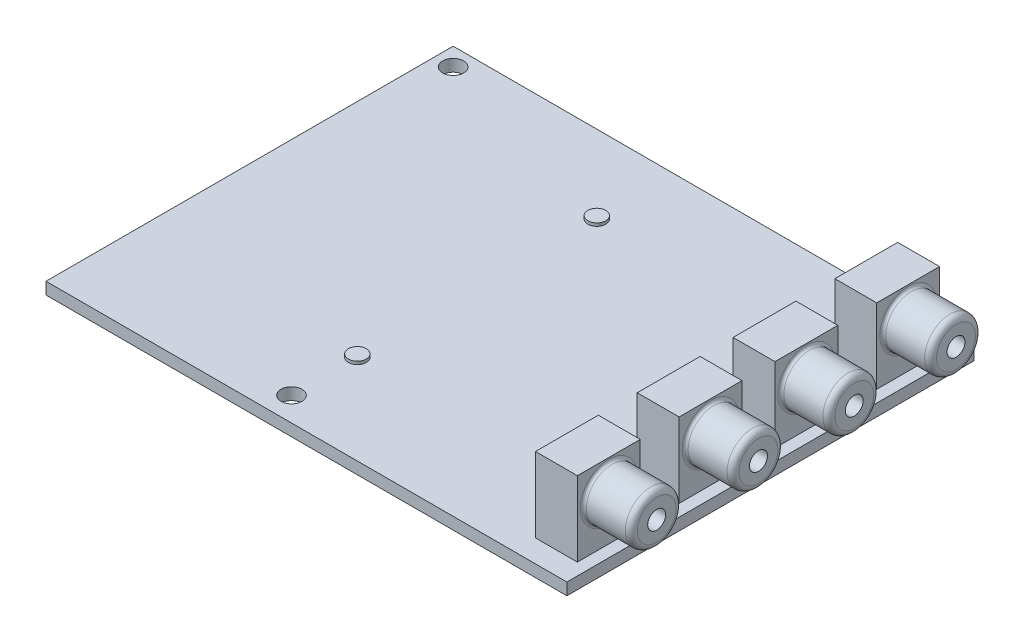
SolidWorks part; units mm, degrees
ref_plane "Спереди" through (0, 0, 0) normal (0, 0, 1) x (1, 0, 0)
ref_plane "Сверху" through (0, 0, 0) normal (0, 1, 0) x (1, 0, 0)
ref_plane "Справа" through (0, 0, 0) normal (1, 0, 0) x (0, 0, -1)
sketch "Эскиз1" plane through (0, 0, 0) normal (0, 1, 0) x (1, 0, 0)
  line L0 (0, 65) -> (87, 65) construction
  line L1 (0, 0) -> (87, 0)
  line L2 (0, 0) -> (0, 68)
  line L3 (0, 68) -> (87, 68)
  line L4 (87, 0) -> (87, 68)
  line L5 (3, 68) -> (3, 0) construction
  line L6 (0, 4) -> (87, 4) construction
  line L7 (73, 68) -> (73, 0) construction
  line L8 (0, 51) -> (87, 51) construction
  line L9 (37, 68) -> (37, 0) construction
  line L10 (0, 17) -> (87, 17) construction
  circle A0 centre (3, 65) radius 1.75
  circle A1 centre (37, 4) radius 1.75
  circle A2 centre (73, 51) radius 1.75
  circle A3 centre (73, 17) radius 1.75
  dimension "D5" = 3.5
  dimension "D1" = 68
  dimension "D2" = 87
  dimension "D3" = 65
  dimension "D4" = 3
  dimension "D6" = 37
  dimension "D7" = 4
  dimension "D8" = 51
  dimension "D9" = 73
  dimension "D10" = 17
extrude "Бобышка-Вытянуть1" add sketch "Эскиз1" along normal blind 2
sketch "Эскиз2" plane through (0, 2, 0) normal (0, 1, 0) x (1, 0, 0)
  line L0 (87, 59) -> (0, 59) construction
  line L1 (87, 0) -> (87, 68) construction
  line L2 (0, 68) -> (0, 0) construction
  line L3 (87, 9) -> (0, 9) construction
  line L4 (87, 26) -> (0, 26) construction
  line L5 (87, 42) -> (0, 42) construction
  line L6 (0, 0) -> (87, 0) construction
  line L7 (81.5, 59) -> (81.5, 9) construction
  line L8 (78, 64.25) -> (85, 64.25)
  line L9 (78, 64.25) -> (78, 53.75)
  line L10 (78, 53.75) -> (85, 53.75)
  line L11 (85, 64.25) -> (85, 53.75)
  line L12 (78, 64.25) -> (85, 53.75) construction
  line L13 (78, 53.75) -> (85, 64.25) construction
  line L14 (85, 64.25) -> (85, 3.75) construction
  line L15 (78, 47.25) -> (85, 47.25)
  line L16 (78, 47.25) -> (78, 36.75)
  line L17 (78, 36.75) -> (85, 36.75)
  line L18 (85, 47.25) -> (85, 36.75)
  line L19 (78, 47.25) -> (85, 36.75) construction
  line L20 (78, 36.75) -> (85, 47.25) construction
  line L21 (78, 31.25) -> (85, 31.25)
  line L22 (78, 31.25) -> (78, 20.75)
  line L23 (78, 20.75) -> (85, 20.75)
  line L24 (85, 31.25) -> (85, 20.75)
  line L25 (78, 31.25) -> (85, 20.75) construction
  line L26 (78, 20.75) -> (85, 31.25) construction
  line L27 (78, 14.25) -> (85, 14.25)
  line L28 (78, 14.25) -> (78, 3.75)
  line L29 (78, 3.75) -> (85, 3.75)
  line L30 (85, 14.25) -> (85, 3.75)
  line L31 (78, 14.25) -> (85, 3.75) construction
  line L32 (78, 3.75) -> (85, 14.25) construction
  point P14 (81.5, 59)
  point P21 (81.5, 42)
  point P26 (81.5, 26)
  dimension "D1" = 9
  dimension "D2" = 26
  dimension "D3" = 42
  dimension "D4" = 59
  dimension "D5" = 85
  dimension "D6" = 10.5
  dimension "D7" = 7
extrude "Бобышка-Вытянуть2" add sketch "Эскиз2" along normal blind 12.5
sketch "Эскиз3" plane through (85, 0, 0) normal (1, 0, 0) x (0, 0, -1)
  line L0 (3.75, 9.5) -> (64.25, 9.5) construction
  line L1 (3.75, 14.5) -> (3.75, 2) construction
  line L2 (64.25, 14.5) -> (64.25, 2) construction
  line L3 (59, 14.5) -> (59, 2) construction
  line L4 (53.75, 14.5) -> (64.25, 14.5) construction
  line L5 (53.75, 2) -> (64.25, 2) construction
  line L6 (42, 14.5) -> (42, 2) construction
  line L7 (36.75, 14.5) -> (47.25, 14.5) construction
  line L8 (36.75, 2) -> (47.25, 2) construction
  line L9 (26, 14.5) -> (26, 2) construction
  line L10 (20.75, 14.5) -> (31.25, 14.5) construction
  line L11 (20.75, 2) -> (31.25, 2) construction
  line L12 (9, 14.5) -> (9, 2) construction
  line L13 (3.75, 14.5) -> (14.25, 14.5) construction
  line L14 (3.75, 2) -> (14.25, 2) construction
  circle A0 centre (9, 9.5) radius 4.25
  circle A1 centre (26, 9.5) radius 4.25
  circle A2 centre (42, 9.5) radius 4.25
  circle A3 centre (59, 9.5) radius 4.25
  circle A4 centre (9, 9.5) radius 1.5
  circle A5 centre (26, 9.5) radius 1.5
  circle A6 centre (42, 9.5) radius 1.5
  circle A7 centre (59, 9.5) radius 1.5
  dimension "D2" = 8.5
  dimension "D3" = 3
  dimension "D1" = 7.5
extrude "Бобышка-Вытянуть3" add sketch "Эскиз3" along normal blind 8
fillet "Скругление1" radius 1 4 edges at (93, 9.5, -63.25) (93, 9.5, -46.25) (93, 9.5, -30.25) (93, 9.5, -13.25)
fillet "Скругление2" radius 0.5 4 edges at (85, 9.5, -54.75) (85, 9.5, -37.75) (85, 9.5, -21.75) (85, 9.5, -4.75)
sketch "Эскиз4" plane through (0, 2, 0) normal (0, 1, 0) x (1, 0, 0)
  line L0 (37, 68) -> (37, 0) construction
  line L1 (87, 68) -> (0, 68) construction
  line L2 (0, 0) -> (87, 0) construction
  line L3 (0, 15) -> (87, 15) construction
  line L4 (0, 68) -> (0, 0) construction
  line L5 (87, 0) -> (87, 68) construction
  line L6 (0, 55) -> (87, 55) construction
  line L7 (0, 34) -> (87, 34) construction
  circle A0 centre (37, 55) radius 1.5
  circle A1 centre (37, 15) radius 1.5
  point P20 (37, 55)
  dimension "D6" = 3
  dimension "D1" = 37
  dimension "D2" = 15
  dimension "D3" = 55
  dimension "D4" = 21
  dimension "D5" = 19
extrude "Бобышка-Вытянуть4" add sketch "Эскиз4" along normal blind 0.5
